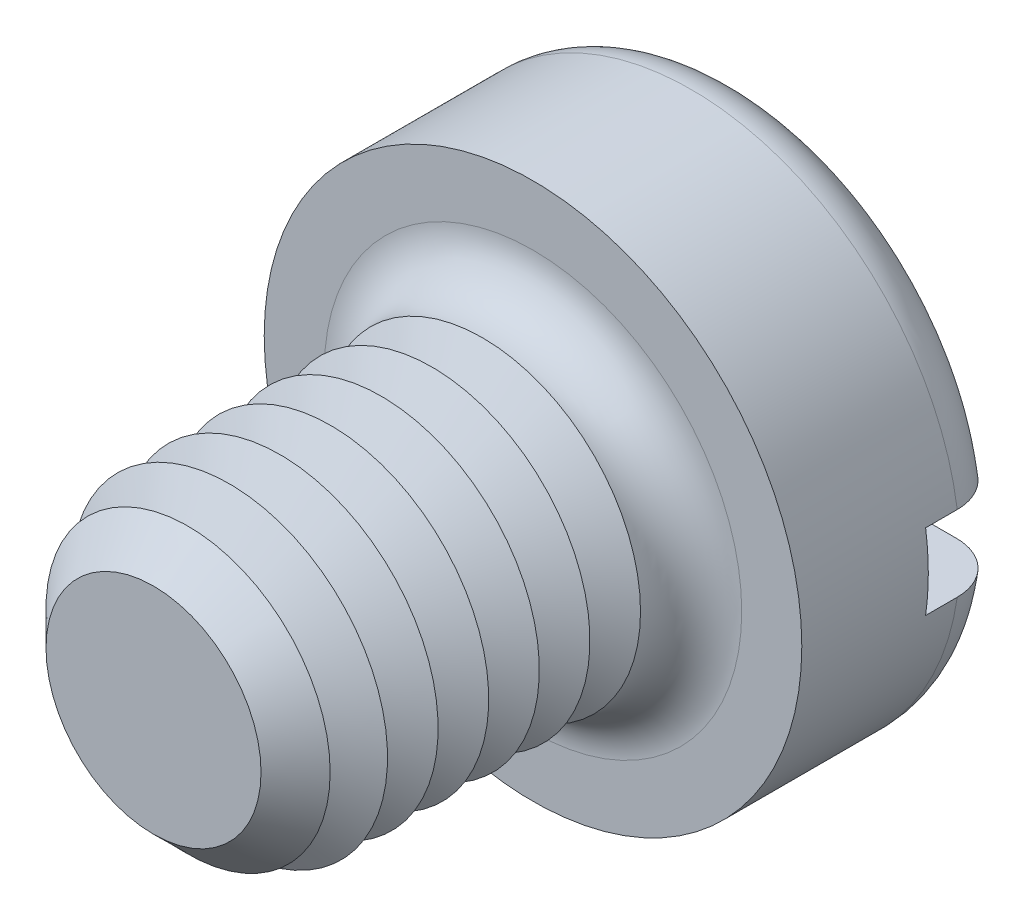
SolidWorks part; units mm, degrees
ref_plane "Front Plane" through (0, 0, 0) normal (0, 0, 1) x (1, 0, 0)
ref_plane "Top Plane" through (0, 0, 0) normal (0, 1, 0) x (1, 0, 0)
ref_plane "Right Plane" through (0, 0, 0) normal (1, 0, 0) x (0, 0, -1)
sketch "Sketch3" plane through (0, 0, 0) normal (0, 0, 1) x (1, 0, 0)
  circle A0 centre (0, 0) radius 4.25
  dimension "D1" = 8.5
extrude "Boss-Extrude2" add sketch "Sketch3" against normal blind 3.3
sketch "Sketch4" plane through (0, 0, 0) normal (0, 0, 1) x (1, 0, 0)
  circle A0 centre (0, 0) radius 2.5
  dimension "D1" = 5
extrude "Boss-Extrude3" add sketch "Sketch4" along normal blind 6
fillet "Fillet1" radius 0.8 2 edges at (4.25, 0, -3.3) (2.5, 0, 0)
chamfer "Chamfer1" distance 0.8 angle 45 1 edges at (2.5, 0, 6)
sketch "Sketch5" plane through (0, 0, 0) normal (1, 0, 0) x (0, 0, -1)
  line L0 (1.6944, 0) -> (-7.6738, 0) construction
sketch "Sketch6" plane through (0, 0, 0) normal (1, 0, 0) x (0, 0, -1)
  line L0 (-0.8, 2.5) -> (-1.2, 1.8072)
  line L1 (-1.2, 1.8072) -> (-1.6, 2.5)
  line L2 (-0.8, 2.5) -> (-5.2, 2.5) construction
  line L3 (-1.6, 2.5) -> (-0.8, 2.5)
  dimension "D1" = 0.8
revolve "Cut-Revolve1" cut sketch "Sketch6" angle 360 about L0
pattern_linear "LPattern1" count 6 spacing 0.8 along (0, 0, 1) of "Cut-Revolve1"
sketch "Sketch8" plane through (0, 0, -3.3) normal (0, 0, -1) x (-1, 0, 0)
  line L1 (4.25, -0.6) -> (-4.25, -0.6)
  line L2 (4.25, -0.6) -> (4.25, 0.6)
  line L3 (4.25, 0.6) -> (-4.25, 0.6)
  line L4 (-4.25, -0.6) -> (-4.25, 0.6)
  line L5 (4.25, -0.6) -> (-4.25, 0.6) construction
  line L6 (4.25, 0.6) -> (-4.25, -0.6) construction
  point P0 (0, 0)
  dimension "D1" = 8.5
  dimension "D2" = 1.2
extrude "Cut-Extrude1" cut sketch "Sketch8" against normal blind 1.3
